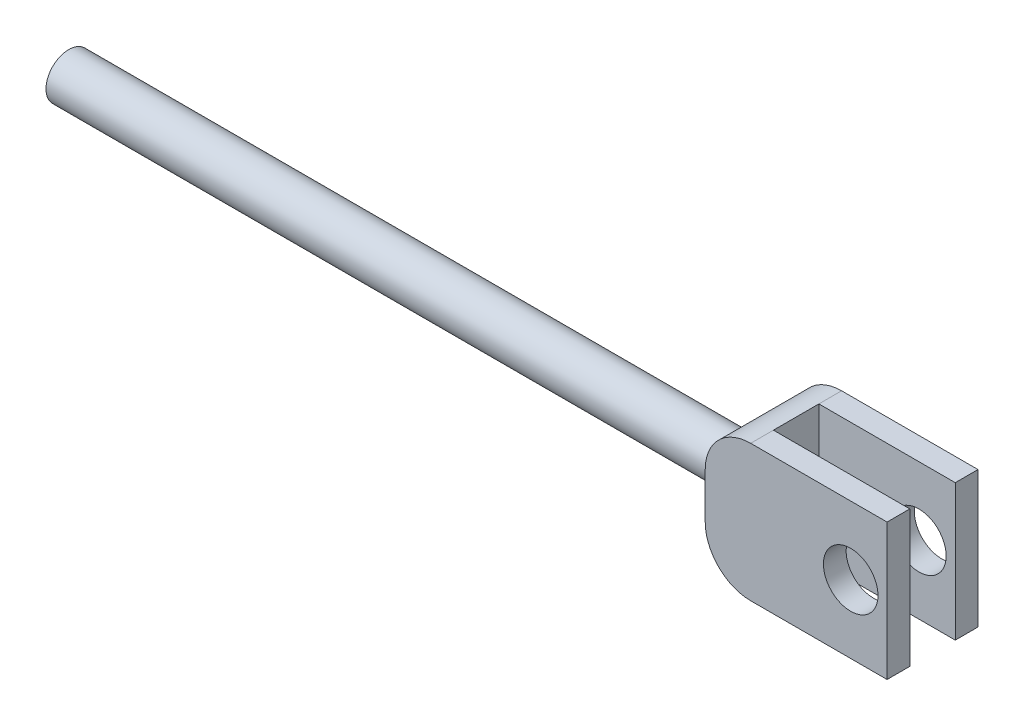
SolidWorks part; units mm, degrees
ref_plane "Face" through (0, 0, 0) normal (0, 0, 1) x (1, 0, 0)
ref_plane "Dessus" through (0, 0, 0) normal (0, 1, 0) x (1, 0, 0)
ref_plane "Droite" through (0, 0, 0) normal (1, 0, 0) x (0, 0, -1)
sketch "Esquisse1" plane through (0, 0, 0) normal (0, 0, 1) x (1, 0, 0)
  line L0 (50, 0) -> (-50, 0) construction
  line L1 (0, 30) -> (-40, 30)
  line L2 (0, 30) -> (0, 0)
  line L3 (0, 0) -> (-40, 0)
  line L4 (-40, 30) -> (-40, 0)
  line L5 (0, -50) -> (0, 50) construction
  dimension "D1" = 40
  dimension "D2" = 30
extrude "Extrusion1" add sketch "Esquisse1" along normal blind 20
fillet "Congé1" radius 10 2 edges at (-40, 0, 10) (-40, 30, 10)
sketch "Esquisse2" plane through (0, 0, 0) normal (1, 0, 0) x (0, 0, -1)
  line L0 (0, 0) -> (0, 30) construction
  line L1 (-15, 56.0547) -> (-5, 56.0547)
  line L2 (-15, 56.0547) -> (-15, -8.6799)
  line L3 (-15, -8.6799) -> (-5, -8.6799)
  line L4 (-5, 56.0547) -> (-5, -8.6799)
  line L5 (-20, 0) -> (-20, 30) construction
  dimension "D1" = 5
  dimension "D2" = 5
extrude "Extrusion2" cut sketch "Esquisse2" against normal blind 30
sketch "Esquisse3" plane through (0, 0, 20) normal (0, 0, 1) x (1, 0, 0)
  line L0 (-30, 0) -> (0, 0) construction
  line L1 (0, 0) -> (0, 30) construction
  circle A0 centre (-8, 15) radius 6
  dimension "D1" = 12
  dimension "D2" = 15
  dimension "D3" = 8
extrude "Extrusion3" cut sketch "Esquisse3" against normal through all
sketch "Esquisse4" plane through (-40, 0, 0) normal (-1, 0, 0) x (0, 0, 1)
  line L0 (0, 20) -> (0, 10) construction
  line L1 (5, 0) -> (0, 0) construction
  circle A0 centre (10, 15) radius 5
  dimension "D1" = 10
  dimension "D2" = 10
  dimension "D3" = 15
extrude "Extrusion4" add sketch "Esquisse4" along normal blind 150
